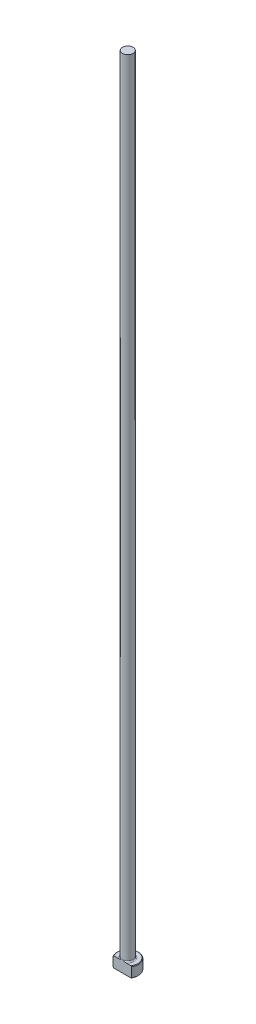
SolidWorks part; units mm, degrees
ref_plane "Front Plane" through (0, 0, 0) normal (0, 0, 1) x (1, 0, 0)
ref_plane "Top Plane" through (0, 0, 0) normal (0, 1, 0) x (1, 0, 0)
ref_plane "Right Plane" through (0, 0, 0) normal (1, 0, 0) x (0, 0, -1)
sketch "Sketch1" plane through (0, 0, 0) normal (0, 0, 1) x (1, 0, 0)
  line L0 (0, 259.9588) -> (0, -15.1925) construction
  line L1 (0, 0) -> (-4.7625, 0)
  line L2 (-4.7625, 0) -> (-4.7625, 4.7498)
  line L3 (-4.7625, 4.7498) -> (-2.3812, 4.7498)
  line L4 (-2.3812, 4.7498) -> (-2.3812, 355.6)
  line L5 (-2.3812, 355.6) -> (0, 355.6)
  line L6 (0, 355.6) -> (0, 0)
  dimension "L" = 355.6
  dimension "H" = 9.525
  dimension "T" = 4.7498
  dimension "D" = 4.7625
revolve "Revolve1" add sketch "Sketch1" angle 360 about L0
chamfer "Chamfer1" distance 0.254 angle 45 2 edges at (0, 4.7498, 4.7625) (0, 0, 4.7625)
fillet "Fillet1" radius 0.508 1 edges at (0, 4.7498, 2.3812)
sketch "Sketch2" plane through (0, 0, 0) normal (0, 1, 0) x (1, 0, 0)
  line L0 (-4.1244, -2.3812) -> (4.1244, -2.3812)
  circle A0 centre (0, 0) radius 4.7625 construction
  arc A1 (-4.1244, -2.3812) -> (4.1244, -2.3812) centre (0, 0) ccw
  circle A3 centre (0, 0) radius 2.3812 construction
  dimension "D1" = 0
extrude "Key" cut sketch "Sketch2" along normal through all
sketch "Pocket Sketch" plane through (0, 0, 0) normal (0, 0, 1) x (1, 0, 0)
  line L0 (-5.1594, 0) -> (-5.1594, 4.7752)
  line L1 (-5.1594, 4.7752) -> (-3.3417, 4.7752)
  line L2 (-2.5797, 5.5372) -> (-2.5797, 22.225)
  line L3 (-2.5797, 22.225) -> (0, 22.225)
  line L4 (0, 22.225) -> (0, 0)
  line L5 (0, 0) -> (-5.1594, 0)
  line L6 (0, 12.6104) -> (0, -2.4989) construction
  line L7 (-4.7625, 4.4958) -> (-4.7625, 0.254) construction
  line L8 (4.5085, 4.7498) -> (-4.5085, 4.7498) construction
  line L9 (-2.3812, 355.6) -> (-2.3812, 5.2578) construction
  line L10 (-3.3417, 4.7752) -> (-2.5797, 5.5372)
  point P3 (-2.5797, 4.7752)
  dimension "D1" = 10.3187
  dimension "D2" = 0.3969
  dimension "D3" = 0.0254
  dimension "D4" = 0.1984
  dimension "D5" = 5.1594
  dimension "D6" = 22.225
